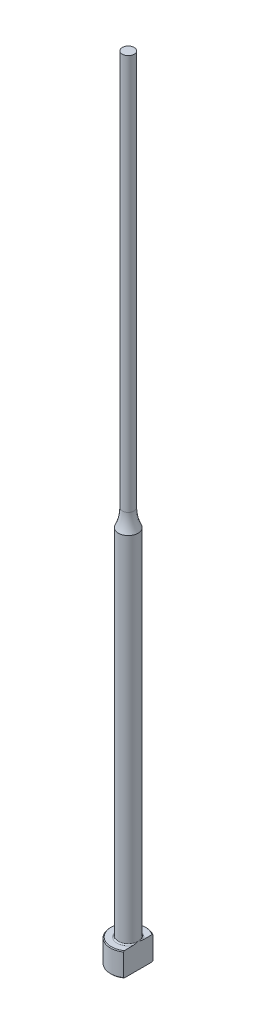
SolidWorks part; units mm, degrees
ref_plane "Front Plane" through (0, 0, 0) normal (0, 0, 1) x (1, 0, 0)
ref_plane "Top Plane" through (0, 0, 0) normal (0, 1, 0) x (1, 0, 0)
ref_plane "Right Plane" through (0, 0, 0) normal (1, 0, 0) x (0, 0, -1)
sketch "Sketch1" plane through (0, 0, 0) normal (0, 0, 1) x (1, 0, 0)
  line L0 (0, 259.9588) -> (0, -15.1925) construction
  line L1 (0, 0) -> (-4.5, 0)
  line L2 (-4.5, 0) -> (-4.5, 6)
  line L3 (-4.5, 6) -> (-2.5, 6)
  line L4 (-1.5, 100) -> (-1.5, 200)
  line L5 (-1.5, 200) -> (0, 200)
  line L6 (0, 200) -> (0, 0)
  line L7 (-2.5, 6) -> (-2.5, 95.6411)
  arc A0 (-2.5, 95.6411) -> (-1.5, 100) centre (-11.5, 100) ccw
  point P13 (-2.25, 0)
  dimension "D1" = 10
  dimension "L" = 200
  dimension "H" = 9
  dimension "T" = 6
  dimension "D" = 3
  dimension "B" = 5
  dimension "S" = 100
revolve "Revolve1" add sketch "Sketch1" angle 360 about L0
chamfer "Chamfer1" distance 0.2 angle 45 2 edges at (0, 6, 4.5) (0, 0, 4.5)
fillet "Fillet1" radius 0.3 1 edges at (0, 6, 2.5)
sketch "Sketch2" plane through (0, 0, 0) normal (0, 1, 0) x (1, 0, 0)
  line L0 (2.5, -3.7417) -> (2.5, 3.7417)
  circle A0 centre (0, 0) radius 4.5 construction
  arc A1 (2.5, -3.7417) -> (2.5, 3.7417) centre (0, 0) ccw
  circle A2 centre (0, 0) radius 2.5 construction
extrude "Keyed Head" cut sketch "Sketch2" along normal through all
